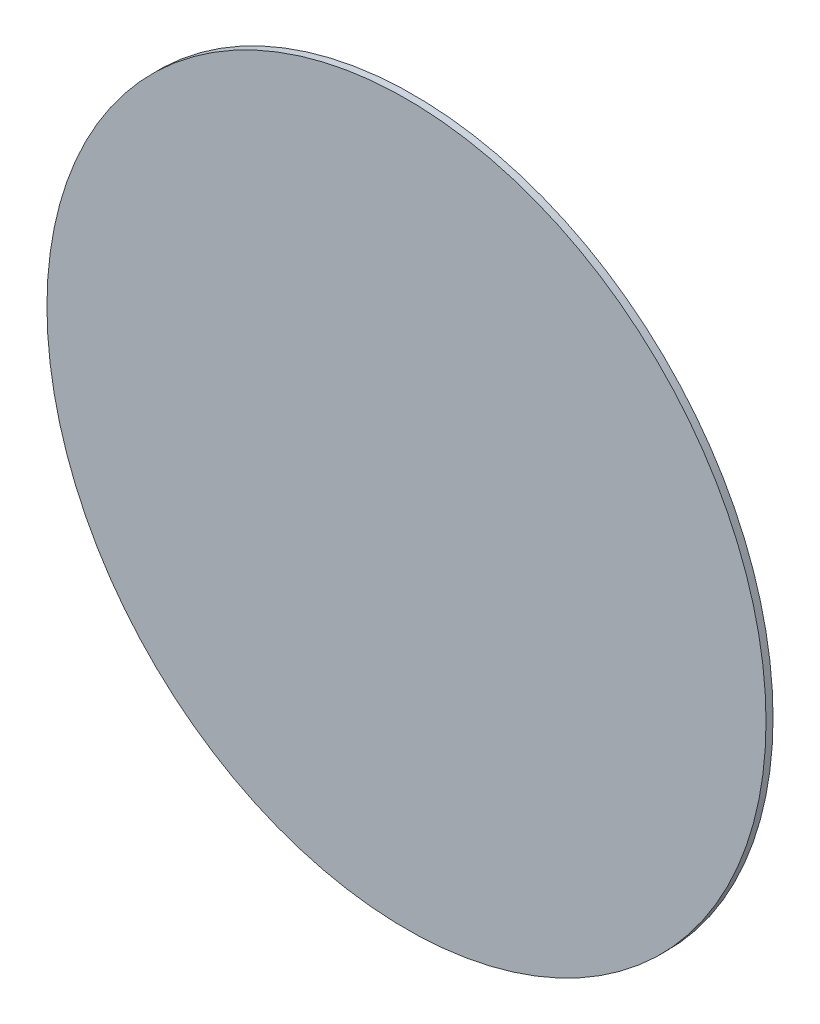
SolidWorks part; units mm, degrees
ref_plane "Front" through (0, 0, 0) normal (0, 0, 1) x (1, 0, 0)
ref_plane "Top" through (0, 0, 0) normal (0, 1, 0) x (1, 0, 0)
ref_plane "Right" through (0, 0, 0) normal (1, 0, 0) x (0, 0, -1)
sketch "Sketch1" plane through (0, 0, 0) normal (0, 0, 1) x (1, 0, 0)
  circle A0 centre (0, 0) radius 6.5
  dimension "D1" = 13
extrude "Extrude1" add sketch "Sketch1" along normal blind 0.127
